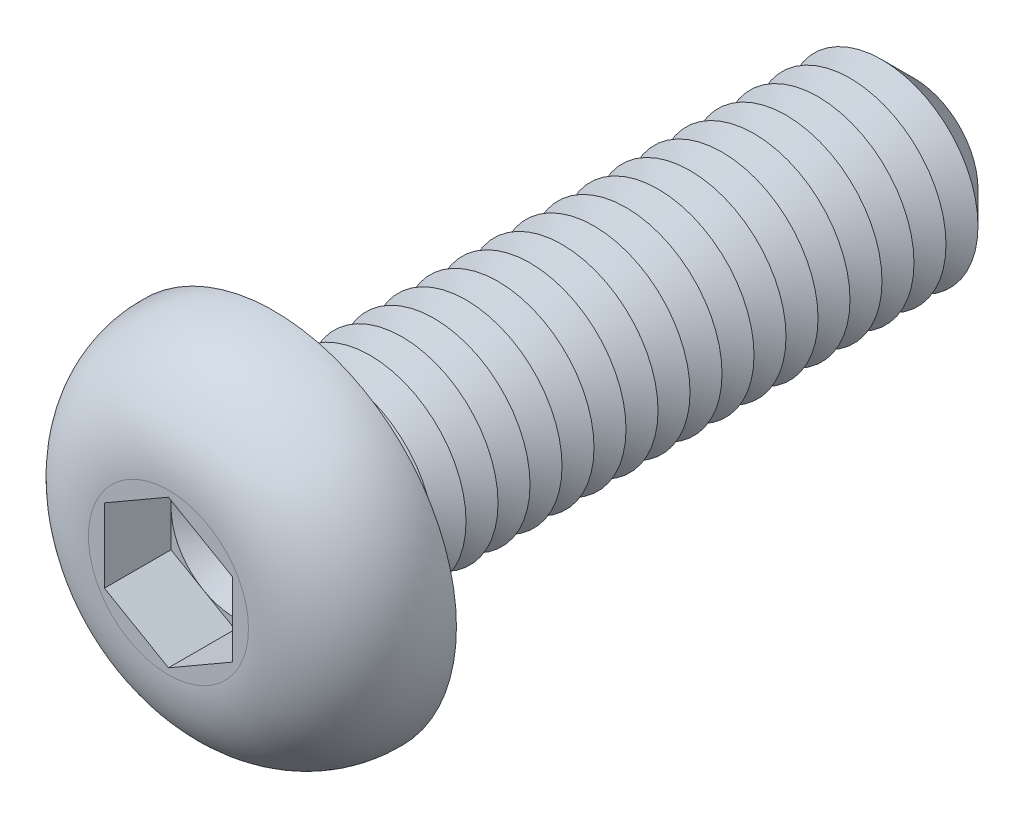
SolidWorks part; units mm, degrees
ref_plane "Front Plane" through (0, 0, 0) normal (0, 0, 1) x (1, 0, 0)
ref_plane "Top Plane" through (0, 0, 0) normal (0, 1, 0) x (1, 0, 0)
ref_plane "Right Plane" through (0, 0, 0) normal (1, 0, 0) x (0, 0, -1)
sketch "Sketch1" plane through (0, 0, 0) normal (1, 0, 0) x (0, 0, -1)
  line L0 (-47.9342, 0) -> (60.3146, 0) construction
sketch "Sketch2" plane through (0, 0, 0) normal (1, 0, 0) x (0, 0, -1)
  line L0 (0, 0) -> (-1.65, 0)
  line L1 (-47.9342, 0) -> (60.3146, 0) construction
  line L2 (-1.65, 0) -> (-1.65, 1.2508)
  line L3 (0, 2.85) -> (0, 0)
  arc A0 (-1.65, 1.2508) -> (0, 2.85) centre (-0.05, 1.2508) cw
  dimension "D1" = 1.6
  dimension "D2" = 1.65
  dimension "D3" = 2.85
revolve "Revolve1" add sketch "Sketch2" angle 360 about L0
sketch "Sketch3" plane through (0, 0, 1.65) normal (0, 0, 1) x (1, 0, 0)
  line L1 (0, 1.1547) -> (-1, 0.5774)
  line L2 (-1, 0.5774) -> (-1, -0.5774)
  line L3 (-1, -0.5774) -> (0, -1.1547)
  line L4 (0, -1.1547) -> (1, -0.5774)
  line L5 (1, -0.5774) -> (1, 0.5774)
  line L6 (1, 0.5774) -> (0, 1.1547)
  circle A0 centre (0, 0) radius 1 construction
  dimension "D1" = 2
extrude "Cut-Extrude1" cut sketch "Sketch3" against normal blind 1.04
sketch "Sketch4" plane through (0, 0, 0) normal (0, 0, -1) x (-1, 0, 0)
  circle A0 centre (0, 0) radius 1.5
  dimension "D1" = 3
extrude "Boss-Extrude1" add sketch "Sketch4" along normal blind 10
chamfer "Chamfer1" distance 0.5 angle 45 1 edges at (-1.5, 0, -10)
sketch "Sketch5" plane through (0, 0, 0) normal (1, 0, 0) x (0, 0, -1)
  line L0 (0.5, 1.5) -> (1, 1.5)
  line L1 (9.5, 1.5) -> (0, 1.5) construction
  line L2 (1, 1.5) -> (0.75, 1.067)
  line L3 (0.75, 1.067) -> (0.5, 1.5)
  line L4 (0, -2.85) -> (0, 2.85) construction
  line L5 (9.5, 1.5) -> (0, 1.5) construction
  dimension "D1" = 0.5
  dimension "D2" = 0.5
revolve "Cut-Revolve1" cut sketch "Sketch5" angle 360 about L0
pattern_linear "LPattern1" count 18 spacing 0.5 along (0, 0, -1) of "Cut-Revolve1"
fillet "Fillet2" radius 0.2 1 edges at (1.5, 0, 0)
sketch "Sketch6" plane through (0, 0, 0.61) normal (0, 0, 1) x (1, 0, 0)
  line L0 (0, -1.1547) -> (1, -0.5774) construction
  circle A0 centre (0, 0) radius 1
extrude "Cut-Extrude2" cut sketch "Sketch6" against normal through all draft 60
